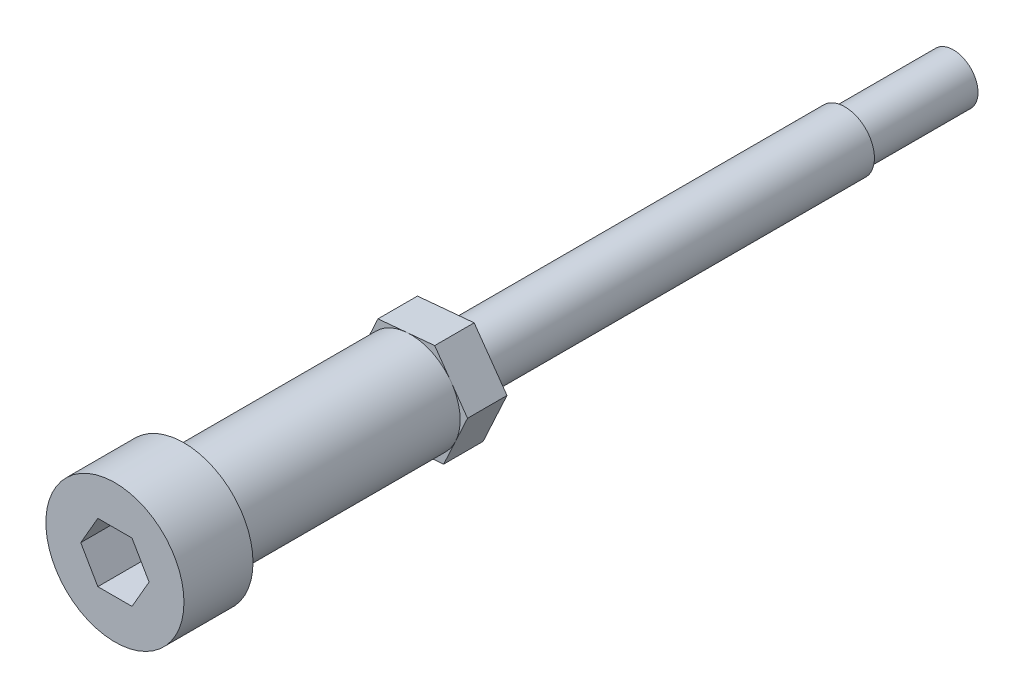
SolidWorks part; units mm, degrees
ref_plane "Plan1" through (0, 0, 0) normal (0, 0, 1) x (1, 0, 0)
ref_plane "Plan2" through (0, 0, 0) normal (0, 1, 0) x (1, 0, 0)
ref_plane "Plan3" through (0, 0, 0) normal (1, 0, 0) x (0, 0, -1)
sketch "Esquisse2" plane through (0, 0, 0) normal (1, 0, 0) x (0, 0, -1)
  line L0 (-67, 0) -> (120, 0) construction
  line L1 (0, 0) -> (0, 14)
  line L2 (0, 14) -> (14, 14)
  line L3 (14, 14) -> (14, 10)
  line L4 (14, 10) -> (60, 10)
  line L5 (60, 10) -> (60, 6)
  line L6 (60, 6) -> (148, 6)
  line L7 (148, 6) -> (148, 5)
  line L8 (148, 5) -> (170, 5)
  line L9 (170, 5) -> (170, 0)
  line L10 (0, 0) -> (170, 0)
  dimension "D1" = 14
  dimension "D2" = 46
  dimension "D3" = 88
  dimension "D4" = 22
  dimension "D5" = 14
  dimension "D6" = 10
  dimension "D7" = 6
  dimension "D8" = 5
revolve "Base-Révolution" add sketch "Esquisse2" angle 360 about L0
sketch "Esquisse3" plane through (0, 0, 0) normal (0, 0, 1) x (1, 0, 0)
  line L1 (6.9282, 0) -> (3.4641, 6)
  line L2 (3.4641, 6) -> (-3.4641, 6)
  line L3 (-3.4641, 6) -> (-6.9282, 0)
  line L4 (-6.9282, 0) -> (-3.4641, -6)
  line L5 (-3.4641, -6) -> (3.4641, -6)
  line L6 (3.4641, -6) -> (6.9282, 0)
  circle A0 centre (0, 0) radius 6 construction
  dimension "D1" = 12
extrude "Enlèv. mat.-Extru.1" cut sketch "Esquisse3" against normal blind 10
sketch "Esquisse5" plane through (0, 0, -60) normal (0, 0, -1) x (-1, 0, 0)
  circle A0 centre (0, 0) radius 6 construction
  circle A1 centre (0, 0) radius 6
sketch "Esquisse7" plane through (0, 0, -60) normal (0, 0, -1) x (-1, 0, 0)
  line L1 (4.8389, -10.4842) -> (11.499, -1.0515)
  line L2 (11.499, -1.0515) -> (6.6602, 9.4327)
  line L3 (6.6602, 9.4327) -> (-4.8389, 10.4842)
  line L4 (-4.8389, 10.4842) -> (-11.499, 1.0515)
  line L5 (-11.499, 1.0515) -> (-6.6602, -9.4327)
  line L6 (-6.6602, -9.4327) -> (4.8389, -10.4842)
  circle A0 centre (0, 0) radius 10 construction
  circle A1 centre (0, 0) radius 10 construction
extrude "Boss.-Extru.1" add sketch "Esquisse7" along normal blind 8
curve "Hélice1"
